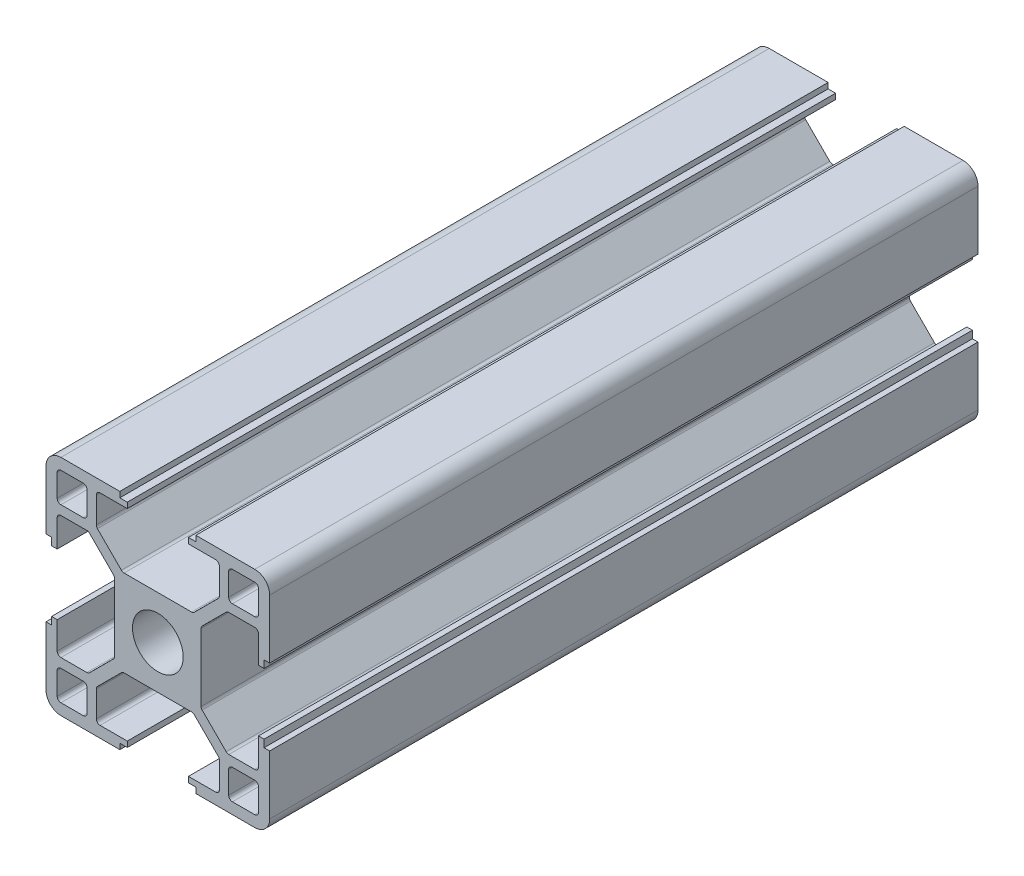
SolidWorks part; units mm, degrees
other "Body1"
ref_plane "Płaszczyzna przednia" through (0, 0, 0) normal (0, 0, 1) x (1, 0, 0)
ref_plane "Płaszczyzna górna" through (0, 0, 0) normal (0, 1, 0) x (1, 0, 0)
ref_plane "Płaszczyzna prawa" through (0, 0, 0) normal (1, 0, 0) x (0, 0, -1)
imported_body "Import1"
sketch "Szkic1" plane through (0, 0, 170) normal (0, 0, 1) x (1, 0, 0)
  line L4 (24.9798, 1.4394) -> (27.9798, 1.4394)
  line L5 (24.4798, 4.9394) -> (24.4798, 1.9394)
  line L6 (27.9798, 5.4394) -> (24.9798, 5.4394)
  line L7 (28.4798, 1.9394) -> (28.4798, 4.9394)
  line L8 (24.9798, 1.4394) -> (27.9798, 1.4394)
  line L9 (24.4798, 4.9394) -> (24.4798, 1.9394)
  line L10 (27.9798, 5.4394) -> (24.9798, 5.4394)
  line L11 (28.4798, 1.9394) -> (28.4798, 4.9394)
  line L12 (1.4798, 4.9394) -> (1.4798, 1.9394)
  line L13 (4.9798, 5.4394) -> (1.9798, 5.4394)
  line L14 (5.4798, 1.9394) -> (5.4798, 4.9394)
  line L15 (1.9798, 1.4394) -> (4.9798, 1.4394)
  line L16 (1.4798, 4.9394) -> (1.4798, 1.9394)
  line L17 (4.9798, 5.4394) -> (1.9798, 5.4394)
  line L18 (5.4798, 1.9394) -> (5.4798, 4.9394)
  line L19 (1.9798, 1.4394) -> (4.9798, 1.4394)
  line L20 (4.9798, 28.4394) -> (1.9798, 28.4394)
  line L21 (5.4798, 24.9394) -> (5.4798, 27.9394)
  line L22 (1.9798, 24.4394) -> (4.9798, 24.4394)
  line L23 (1.4798, 27.9394) -> (1.4798, 24.9394)
  line L24 (4.9798, 28.4394) -> (1.9798, 28.4394)
  line L25 (5.4798, 24.9394) -> (5.4798, 27.9394)
  line L26 (1.9798, 24.4394) -> (4.9798, 24.4394)
  line L27 (1.4798, 27.9394) -> (1.4798, 24.9394)
  line L28 (28.4798, 24.9394) -> (28.4798, 27.9394)
  line L29 (24.9798, 24.4394) -> (27.9798, 24.4394)
  line L30 (24.4798, 27.9394) -> (24.4798, 24.9394)
  line L31 (27.9798, 28.4394) -> (24.9798, 28.4394)
  line L32 (28.4798, 24.9394) -> (28.4798, 27.9394)
  line L33 (24.9798, 24.4394) -> (27.9798, 24.4394)
  line L34 (24.4798, 27.9394) -> (24.4798, 24.9394)
  line L35 (27.9798, 28.4394) -> (24.9798, 28.4394)
  line L60 (-0.0202, 9.8394) -> (-0.0202, 1.9394)
  line L61 (1.9798, -0.0606) -> (9.8798, -0.0606)
  line L62 (9.8798, -0.0606) -> (9.8798, 0.6894)
  line L63 (9.8798, 0.6894) -> (10.8798, 0.6894)
  line L64 (10.8798, 0.6894) -> (10.8798, 1.4394)
  line L65 (10.8798, 1.4394) -> (7.2298, 1.4394)
  line L66 (6.7298, 1.9394) -> (6.7298, 5.4216)
  line L67 (6.8762, 5.7752) -> (10.094, 8.9929)
  line L68 (10.4475, 9.1394) -> (19.512, 9.1394)
  line L69 (19.8656, 8.9929) -> (23.0833, 5.7752)
  line L70 (23.2298, 5.4216) -> (23.2298, 1.9394)
  line L71 (22.7298, 1.4394) -> (19.0798, 1.4394)
  line L72 (19.0798, 1.4394) -> (19.0798, 0.6894)
  line L73 (19.0798, 0.6894) -> (20.0798, 0.6894)
  line L74 (20.0798, 0.6894) -> (20.0798, -0.0606)
  line L75 (20.0798, -0.0606) -> (27.9798, -0.0606)
  line L76 (29.9798, 1.9394) -> (29.9798, 9.8394)
  line L77 (29.9798, 9.8394) -> (29.2298, 9.8394)
  line L78 (29.2298, 9.8394) -> (29.2298, 10.8394)
  line L79 (29.2298, 10.8394) -> (28.4798, 10.8394)
  line L80 (28.4798, 10.8394) -> (28.4798, 7.1894)
  line L81 (27.9798, 6.6894) -> (24.4975, 6.6894)
  line L82 (24.144, 6.8358) -> (20.9262, 10.0536)
  line L83 (20.7798, 10.4071) -> (20.7798, 19.4716)
  line L84 (20.9262, 19.8252) -> (24.144, 23.0429)
  line L85 (24.4975, 23.1894) -> (27.9798, 23.1894)
  line L86 (28.4798, 22.6894) -> (28.4798, 19.0394)
  line L87 (28.4798, 19.0394) -> (29.2298, 19.0394)
  line L88 (29.2298, 19.0394) -> (29.2298, 20.0394)
  line L89 (29.2298, 20.0394) -> (29.9798, 20.0394)
  line L90 (29.9798, 20.0394) -> (29.9798, 27.9394)
  line L91 (27.9798, 29.9394) -> (20.0798, 29.9394)
  line L92 (20.0798, 29.9394) -> (20.0798, 29.1894)
  line L93 (20.0798, 29.1894) -> (19.0798, 29.1894)
  line L94 (19.0798, 29.1894) -> (19.0798, 28.4394)
  line L95 (19.0798, 28.4394) -> (22.7298, 28.4394)
  line L96 (23.2298, 27.9394) -> (23.2298, 24.4571)
  line L97 (23.0833, 24.1036) -> (19.8656, 20.8858)
  line L98 (19.512, 20.7394) -> (10.4475, 20.7394)
  line L99 (10.094, 20.8858) -> (6.8762, 24.1036)
  line L100 (6.7298, 24.4571) -> (6.7298, 27.9394)
  line L101 (7.2298, 28.4394) -> (10.8798, 28.4394)
  line L102 (10.8798, 28.4394) -> (10.8798, 29.1894)
  line L103 (10.8798, 29.1894) -> (9.8798, 29.1894)
  line L104 (9.8798, 29.1894) -> (9.8798, 29.9394)
  line L105 (9.8798, 29.9394) -> (1.9798, 29.9394)
  line L106 (-0.0202, 27.9394) -> (-0.0202, 20.0394)
  line L107 (-0.0202, 20.0394) -> (0.7298, 20.0394)
  line L108 (0.7298, 20.0394) -> (0.7298, 19.0394)
  line L109 (0.7298, 19.0394) -> (1.4798, 19.0394)
  line L110 (1.4798, 19.0394) -> (1.4798, 22.6894)
  line L111 (1.9798, 23.1894) -> (5.462, 23.1894)
  line L112 (5.8156, 23.0429) -> (9.0333, 19.8252)
  line L113 (9.1798, 19.4716) -> (9.1798, 10.4071)
  line L114 (9.0333, 10.0536) -> (5.8156, 6.8358)
  line L115 (5.462, 6.6894) -> (1.9798, 6.6894)
  line L116 (1.4798, 7.1894) -> (1.4798, 10.8394)
  line L117 (1.4798, 10.8394) -> (0.7298, 10.8394)
  line L118 (0.7298, 10.8394) -> (0.7298, 9.8394)
  line L119 (0.7298, 9.8394) -> (-0.0202, 9.8394)
  line L120 (-0.0202, 9.8394) -> (-0.0202, 1.9394)
  line L121 (1.9798, -0.0606) -> (9.8798, -0.0606)
  line L122 (9.8798, -0.0606) -> (9.8798, 0.6894)
  line L123 (9.8798, 0.6894) -> (10.8798, 0.6894)
  line L124 (10.8798, 0.6894) -> (10.8798, 1.4394)
  line L125 (10.8798, 1.4394) -> (7.2298, 1.4394)
  line L126 (6.7298, 1.9394) -> (6.7298, 5.4216)
  line L127 (6.8762, 5.7752) -> (10.094, 8.9929)
  line L128 (10.4475, 9.1394) -> (19.512, 9.1394)
  line L129 (19.8656, 8.9929) -> (23.0833, 5.7752)
  line L130 (23.2298, 5.4216) -> (23.2298, 1.9394)
  line L131 (22.7298, 1.4394) -> (19.0798, 1.4394)
  line L132 (19.0798, 1.4394) -> (19.0798, 0.6894)
  line L133 (19.0798, 0.6894) -> (20.0798, 0.6894)
  line L134 (20.0798, 0.6894) -> (20.0798, -0.0606)
  line L135 (20.0798, -0.0606) -> (27.9798, -0.0606)
  line L136 (29.9798, 1.9394) -> (29.9798, 9.8394)
  line L137 (29.9798, 9.8394) -> (29.2298, 9.8394)
  line L138 (29.2298, 9.8394) -> (29.2298, 10.8394)
  line L139 (29.2298, 10.8394) -> (28.4798, 10.8394)
  line L140 (28.4798, 10.8394) -> (28.4798, 7.1894)
  line L141 (27.9798, 6.6894) -> (24.4975, 6.6894)
  line L142 (24.144, 6.8358) -> (20.9262, 10.0536)
  line L143 (20.7798, 10.4071) -> (20.7798, 19.4716)
  line L144 (20.9262, 19.8252) -> (24.144, 23.0429)
  line L145 (24.4975, 23.1894) -> (27.9798, 23.1894)
  line L146 (28.4798, 22.6894) -> (28.4798, 19.0394)
  line L147 (28.4798, 19.0394) -> (29.2298, 19.0394)
  line L148 (29.2298, 19.0394) -> (29.2298, 20.0394)
  line L149 (29.2298, 20.0394) -> (29.9798, 20.0394)
  line L150 (29.9798, 20.0394) -> (29.9798, 27.9394)
  line L151 (27.9798, 29.9394) -> (20.0798, 29.9394)
  line L152 (20.0798, 29.9394) -> (20.0798, 29.1894)
  line L153 (20.0798, 29.1894) -> (19.0798, 29.1894)
  line L154 (19.0798, 29.1894) -> (19.0798, 28.4394)
  line L155 (19.0798, 28.4394) -> (22.7298, 28.4394)
  line L156 (23.2298, 27.9394) -> (23.2298, 24.4571)
  line L157 (23.0833, 24.1036) -> (19.8656, 20.8858)
  line L158 (19.512, 20.7394) -> (10.4475, 20.7394)
  line L159 (10.094, 20.8858) -> (6.8762, 24.1036)
  line L160 (6.7298, 24.4571) -> (6.7298, 27.9394)
  line L161 (7.2298, 28.4394) -> (10.8798, 28.4394)
  line L162 (10.8798, 28.4394) -> (10.8798, 29.1894)
  line L163 (10.8798, 29.1894) -> (9.8798, 29.1894)
  line L164 (9.8798, 29.1894) -> (9.8798, 29.9394)
  line L165 (9.8798, 29.9394) -> (1.9798, 29.9394)
  line L166 (-0.0202, 27.9394) -> (-0.0202, 20.0394)
  line L167 (-0.0202, 20.0394) -> (0.7298, 20.0394)
  line L168 (0.7298, 20.0394) -> (0.7298, 19.0394)
  line L169 (0.7298, 19.0394) -> (1.4798, 19.0394)
  line L170 (1.4798, 19.0394) -> (1.4798, 22.6894)
  line L171 (1.9798, 23.1894) -> (5.462, 23.1894)
  line L172 (5.8156, 23.0429) -> (9.0333, 19.8252)
  line L173 (9.1798, 19.4716) -> (9.1798, 10.4071)
  line L174 (9.0333, 10.0536) -> (5.8156, 6.8358)
  line L175 (5.462, 6.6894) -> (1.9798, 6.6894)
  line L176 (1.4798, 7.1894) -> (1.4798, 10.8394)
  line L177 (1.4798, 10.8394) -> (0.7298, 10.8394)
  line L178 (0.7298, 10.8394) -> (0.7298, 9.8394)
  line L179 (0.7298, 9.8394) -> (-0.0202, 9.8394)
  circle A1 centre (14.9798, 14.9394) radius 3.4
  circle A2 centre (14.9798, 14.9394) radius 3.4
  arc A4 (27.9798, 1.4394) -> (28.4798, 1.9394) centre (27.9798, 1.9394) ccw
  arc A5 (24.4798, 1.9394) -> (24.9798, 1.4394) centre (24.9798, 1.9394) ccw
  arc A6 (24.9798, 5.4394) -> (24.4798, 4.9394) centre (24.9798, 4.9394) ccw
  arc A7 (28.4798, 4.9394) -> (27.9798, 5.4394) centre (27.9798, 4.9394) ccw
  arc A8 (27.9798, 1.4394) -> (28.4798, 1.9394) centre (27.9798, 1.9394) ccw
  arc A9 (24.4798, 1.9394) -> (24.9798, 1.4394) centre (24.9798, 1.9394) ccw
  arc A10 (24.9798, 5.4394) -> (24.4798, 4.9394) centre (24.9798, 4.9394) ccw
  arc A11 (28.4798, 4.9394) -> (27.9798, 5.4394) centre (27.9798, 4.9394) ccw
  arc A12 (1.4798, 1.9394) -> (1.9798, 1.4394) centre (1.9798, 1.9394) ccw
  arc A13 (1.9798, 5.4394) -> (1.4798, 4.9394) centre (1.9798, 4.9394) ccw
  arc A14 (5.4798, 4.9394) -> (4.9798, 5.4394) centre (4.9798, 4.9394) ccw
  arc A15 (4.9798, 1.4394) -> (5.4798, 1.9394) centre (4.9798, 1.9394) ccw
  arc A16 (1.4798, 1.9394) -> (1.9798, 1.4394) centre (1.9798, 1.9394) ccw
  arc A17 (1.9798, 5.4394) -> (1.4798, 4.9394) centre (1.9798, 4.9394) ccw
  arc A18 (5.4798, 4.9394) -> (4.9798, 5.4394) centre (4.9798, 4.9394) ccw
  arc A19 (4.9798, 1.4394) -> (5.4798, 1.9394) centre (4.9798, 1.9394) ccw
  arc A22 (1.9798, 28.4394) -> (1.4798, 27.9394) centre (1.9798, 27.9394) ccw
  arc A23 (5.4798, 27.9394) -> (4.9798, 28.4394) centre (4.9798, 27.9394) ccw
  arc A24 (4.9798, 24.4394) -> (5.4798, 24.9394) centre (4.9798, 24.9394) ccw
  arc A25 (1.4798, 24.9394) -> (1.9798, 24.4394) centre (1.9798, 24.9394) ccw
  arc A26 (1.9798, 28.4394) -> (1.4798, 27.9394) centre (1.9798, 27.9394) ccw
  arc A27 (5.4798, 27.9394) -> (4.9798, 28.4394) centre (4.9798, 27.9394) ccw
  arc A28 (-0.0202, 1.9394) -> (1.9798, -0.0606) centre (1.9798, 1.9394) ccw
  arc A29 (6.7298, 1.9394) -> (7.2298, 1.4394) centre (7.2298, 1.9394) ccw
  arc A30 (6.8762, 5.7752) -> (6.7298, 5.4216) centre (7.2298, 5.4216) ccw
  arc A31 (10.4475, 9.1394) -> (10.094, 8.9929) centre (10.4475, 8.6394) ccw
  arc A32 (19.8656, 8.9929) -> (19.512, 9.1394) centre (19.512, 8.6394) ccw
  arc A33 (23.2298, 5.4216) -> (23.0833, 5.7752) centre (22.7298, 5.4216) ccw
  arc A34 (22.7298, 1.4394) -> (23.2298, 1.9394) centre (22.7298, 1.9394) ccw
  arc A35 (27.9798, -0.0606) -> (29.9798, 1.9394) centre (27.9798, 1.9394) ccw
  arc A36 (27.9798, 6.6894) -> (28.4798, 7.1894) centre (27.9798, 7.1894) ccw
  arc A37 (24.144, 6.8358) -> (24.4975, 6.6894) centre (24.4975, 7.1894) ccw
  arc A38 (20.7798, 10.4071) -> (20.9262, 10.0536) centre (21.2798, 10.4071) ccw
  arc A39 (20.9262, 19.8252) -> (20.7798, 19.4716) centre (21.2798, 19.4716) ccw
  arc A40 (24.4975, 23.1894) -> (24.144, 23.0429) centre (24.4975, 22.6894) ccw
  arc A41 (28.4798, 22.6894) -> (27.9798, 23.1894) centre (27.9798, 22.6894) ccw
  arc A42 (29.9798, 27.9394) -> (27.9798, 29.9394) centre (27.9798, 27.9394) ccw
  arc A43 (23.2298, 27.9394) -> (22.7298, 28.4394) centre (22.7298, 27.9394) ccw
  arc A44 (23.0833, 24.1036) -> (23.2298, 24.4571) centre (22.7298, 24.4571) ccw
  arc A45 (19.512, 20.7394) -> (19.8656, 20.8858) centre (19.512, 21.2394) ccw
  arc A46 (10.094, 20.8858) -> (10.4475, 20.7394) centre (10.4475, 21.2394) ccw
  arc A47 (6.7298, 24.4571) -> (6.8762, 24.1036) centre (7.2298, 24.4571) ccw
  arc A48 (7.2298, 28.4394) -> (6.7298, 27.9394) centre (7.2298, 27.9394) ccw
  arc A49 (1.9798, 29.9394) -> (-0.0202, 27.9394) centre (1.9798, 27.9394) ccw
  arc A50 (1.9798, 23.1894) -> (1.4798, 22.6894) centre (1.9798, 22.6894) ccw
  arc A51 (5.8156, 23.0429) -> (5.462, 23.1894) centre (5.462, 22.6894) ccw
  arc A52 (9.1798, 19.4716) -> (9.0333, 19.8252) centre (8.6798, 19.4716) ccw
  arc A53 (9.0333, 10.0536) -> (9.1798, 10.4071) centre (8.6798, 10.4071) ccw
  arc A54 (5.462, 6.6894) -> (5.8156, 6.8358) centre (5.462, 7.1894) ccw
  arc A55 (1.4798, 7.1894) -> (1.9798, 6.6894) centre (1.9798, 7.1894) ccw
  arc A56 (-0.0202, 1.9394) -> (1.9798, -0.0606) centre (1.9798, 1.9394) ccw
  arc A57 (6.7298, 1.9394) -> (7.2298, 1.4394) centre (7.2298, 1.9394) ccw
  arc A58 (6.8762, 5.7752) -> (6.7298, 5.4216) centre (7.2298, 5.4216) ccw
  arc A59 (10.4475, 9.1394) -> (10.094, 8.9929) centre (10.4475, 8.6394) ccw
  arc A60 (19.8656, 8.9929) -> (19.512, 9.1394) centre (19.512, 8.6394) ccw
  arc A61 (23.2298, 5.4216) -> (23.0833, 5.7752) centre (22.7298, 5.4216) ccw
  arc A62 (22.7298, 1.4394) -> (23.2298, 1.9394) centre (22.7298, 1.9394) ccw
  arc A63 (27.9798, -0.0606) -> (29.9798, 1.9394) centre (27.9798, 1.9394) ccw
  arc A64 (27.9798, 6.6894) -> (28.4798, 7.1894) centre (27.9798, 7.1894) ccw
  arc A65 (24.144, 6.8358) -> (24.4975, 6.6894) centre (24.4975, 7.1894) ccw
  arc A66 (20.7798, 10.4071) -> (20.9262, 10.0536) centre (21.2798, 10.4071) ccw
  arc A67 (20.9262, 19.8252) -> (20.7798, 19.4716) centre (21.2798, 19.4716) ccw
  arc A68 (24.4975, 23.1894) -> (24.144, 23.0429) centre (24.4975, 22.6894) ccw
  arc A69 (28.4798, 22.6894) -> (27.9798, 23.1894) centre (27.9798, 22.6894) ccw
  arc A70 (29.9798, 27.9394) -> (27.9798, 29.9394) centre (27.9798, 27.9394) ccw
  arc A71 (23.2298, 27.9394) -> (22.7298, 28.4394) centre (22.7298, 27.9394) ccw
  arc A72 (23.0833, 24.1036) -> (23.2298, 24.4571) centre (22.7298, 24.4571) ccw
  arc A73 (19.512, 20.7394) -> (19.8656, 20.8858) centre (19.512, 21.2394) ccw
  arc A74 (10.094, 20.8858) -> (10.4475, 20.7394) centre (10.4475, 21.2394) ccw
  arc A75 (6.7298, 24.4571) -> (6.8762, 24.1036) centre (7.2298, 24.4571) ccw
  arc A76 (7.2298, 28.4394) -> (6.7298, 27.9394) centre (7.2298, 27.9394) ccw
  arc A77 (1.9798, 29.9394) -> (-0.0202, 27.9394) centre (1.9798, 27.9394) ccw
  arc A78 (1.9798, 23.1894) -> (1.4798, 22.6894) centre (1.9798, 22.6894) ccw
  arc A79 (5.8156, 23.0429) -> (5.462, 23.1894) centre (5.462, 22.6894) ccw
  arc A80 (9.1798, 19.4716) -> (9.0333, 19.8252) centre (8.6798, 19.4716) ccw
  arc A81 (9.0333, 10.0536) -> (9.1798, 10.4071) centre (8.6798, 10.4071) ccw
  arc A82 (5.462, 6.6894) -> (5.8156, 6.8358) centre (5.462, 7.1894) ccw
  arc A83 (1.4798, 7.1894) -> (1.9798, 6.6894) centre (1.9798, 7.1894) ccw
  arc A84 (4.9798, 24.4394) -> (5.4798, 24.9394) centre (4.9798, 24.9394) ccw
  arc A85 (1.4798, 24.9394) -> (1.9798, 24.4394) centre (1.9798, 24.9394) ccw
  arc A86 (28.4798, 27.9394) -> (27.9798, 28.4394) centre (27.9798, 27.9394) ccw
  arc A87 (27.9798, 24.4394) -> (28.4798, 24.9394) centre (27.9798, 24.9394) ccw
  arc A88 (24.4798, 24.9394) -> (24.9798, 24.4394) centre (24.9798, 24.9394) ccw
  arc A89 (24.9798, 28.4394) -> (24.4798, 27.9394) centre (24.9798, 27.9394) ccw
  arc A90 (28.4798, 27.9394) -> (27.9798, 28.4394) centre (27.9798, 27.9394) ccw
  arc A91 (27.9798, 24.4394) -> (28.4798, 24.9394) centre (27.9798, 24.9394) ccw
  arc A92 (24.4798, 24.9394) -> (24.9798, 24.4394) centre (24.9798, 24.9394) ccw
  arc A93 (24.9798, 28.4394) -> (24.4798, 27.9394) centre (24.9798, 27.9394) ccw
  dimension "D1" = 0
  dimension "D2" = 0
  dimension "D3" = 0
  dimension "D4" = 0
  dimension "D5" = 0
  dimension "D6" = 0
extrude "Wytnij-wyciągnięcie2" cut sketch "Szkic1" against normal blind 245
